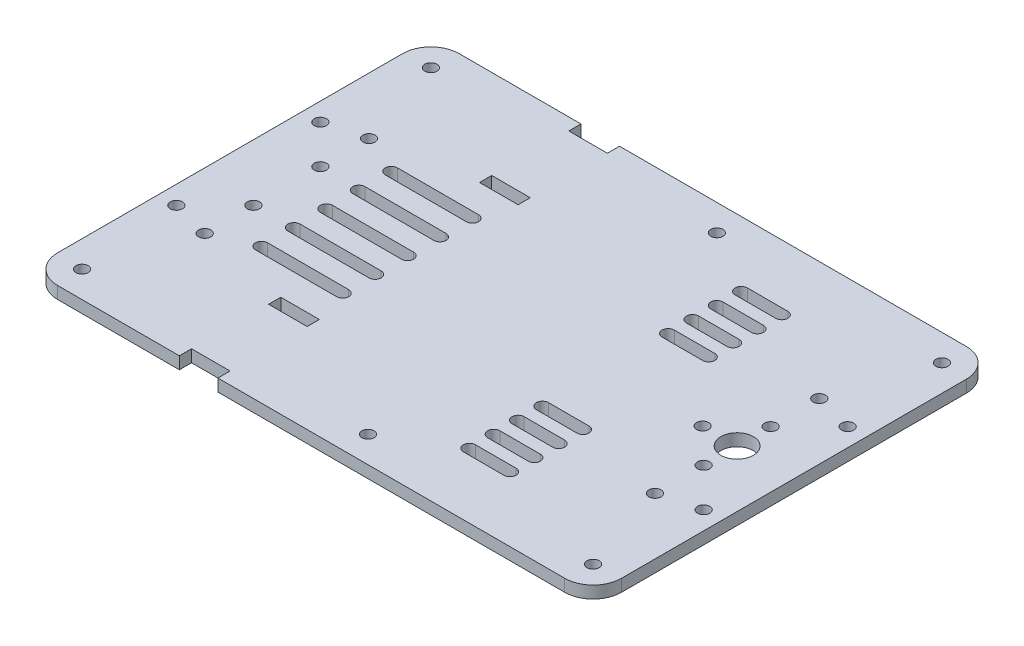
SolidWorks part; units mm, degrees
ref_plane "Front Plane" through (0, 0, 0) normal (0, 0, 1) x (1, 0, 0)
ref_plane "Top Plane" through (0, 0, 0) normal (0, 1, 0) x (1, 0, 0)
ref_plane "Right Plane" through (0, 0, 0) normal (1, 0, 0) x (0, 0, -1)
sketch "Sketch1" plane through (0, 0, 0) normal (0, 1, 0) x (1, 0, 0)
  line L0 (-32.5, 46.5) -> (-23, 46.5)
  line L1 (62.5, -49.5) -> (-62.5, -49.5)
  line L2 (69.5, -42.5) -> (69.5, 42.5)
  line L3 (62.5, 49.5) -> (-62.5, 49.5)
  line L4 (-69.5, -42.5) -> (-69.5, 42.5)
  line L5 (0, 49.5) -> (0, -49.5) construction
  line L6 (69.5, 0) -> (-69.5, 0) construction
  line L7 (-32.5, -49.5) -> (-23, -49.5)
  line L8 (-32.5, -49.5) -> (-32.5, -46.5)
  line L9 (-32.5, -46.5) -> (-23, -46.5)
  line L10 (-23, -49.5) -> (-23, -46.5)
  line L11 (-23, 49.5) -> (-23, 46.5)
  line L12 (-32.5, 49.5) -> (-23, 49.5)
  line L13 (-32.5, 49.5) -> (-32.5, 46.5)
  line L14 (-32.5, 24.5) -> (-23, 24.5)
  line L15 (-32.5, -27.5) -> (-23, -27.5)
  line L16 (-32.5, -27.5) -> (-32.5, -24.5)
  line L17 (-32.5, -24.5) -> (-23, -24.5)
  line L18 (-23, -27.5) -> (-23, -24.5)
  line L19 (-23, 27.5) -> (-23, 24.5)
  line L20 (-32.5, 27.5) -> (-23, 27.5)
  line L21 (-32.5, 27.5) -> (-32.5, 24.5)
  line L22 (-63, 43) -> (63, 43) construction
  line L23 (-63, -43) -> (63, -43) construction
  line L24 (33, 15.5) -> (23, 15.5) construction
  line L25 (33, 14) -> (23, 14)
  line L26 (33, 17) -> (23, 17)
  line L27 (33, -15.5) -> (23, -15.5) construction
  line L28 (33, -14) -> (23, -14)
  line L29 (33, -17) -> (23, -17)
  line L30 (-45.75, 16) -> (-25.75, 16) construction
  line L31 (-45.75, 17.5) -> (-25.75, 17.5)
  line L32 (-45.75, 14.5) -> (-25.75, 14.5)
  line L33 (-24.25, 27.75) -> (-24.25, 20.7276) construction
  line L34 (-45.75, 6.5) -> (-25.75, 6.5)
  line L35 (-45.75, 9.5) -> (-25.75, 9.5)
  line L36 (-45.75, 8) -> (-25.75, 8) construction
  line L37 (-45.75, -1.5) -> (-25.75, -1.5)
  line L38 (-45.75, 1.5) -> (-25.75, 1.5)
  line L39 (-45.75, 0) -> (-25.75, 0) construction
  line L40 (-45.75, -9.5) -> (-25.75, -9.5)
  line L41 (-45.75, -6.5) -> (-25.75, -6.5)
  line L42 (-45.75, -8) -> (-25.75, -8) construction
  line L43 (-45.75, -17.5) -> (-25.75, -17.5)
  line L44 (-45.75, -14.5) -> (-25.75, -14.5)
  line L45 (-45.75, -16) -> (-25.75, -16) construction
  line L46 (-63.5, 13.5) -> (-63.5, -10.25) construction
  line L47 (33, 23) -> (23, 23)
  line L48 (33, 20) -> (23, 20)
  line L49 (33, 21.5) -> (23, 21.5) construction
  line L50 (33, 29) -> (23, 29)
  line L51 (33, 26) -> (23, 26)
  line L52 (33, 27.5) -> (23, 27.5) construction
  line L53 (33, 35) -> (23, 35)
  line L54 (33, 32) -> (23, 32)
  line L55 (33, 33.5) -> (23, 33.5) construction
  line L56 (33, -33.5) -> (23, -33.5) construction
  line L57 (33, -32) -> (23, -32)
  line L58 (33, -35) -> (23, -35)
  line L59 (33, -27.5) -> (23, -27.5) construction
  line L60 (33, -26) -> (23, -26)
  line L61 (33, -29) -> (23, -29)
  line L62 (33, -21.5) -> (23, -21.5) construction
  line L63 (33, -20) -> (23, -20)
  line L64 (33, -23) -> (23, -23)
  arc A0 (69.5, 42.5) -> (62.5, 49.5) centre (62.5, 42.5) ccw
  arc A1 (62.5, -49.5) -> (69.5, -42.5) centre (62.5, -42.5) ccw
  arc A2 (-62.5, -49.5) -> (-69.5, -42.5) centre (-62.5, -42.5) cw
  arc A3 (-62.5, 49.5) -> (-69.5, 42.5) centre (-62.5, 42.5) ccw
  circle A4 centre (-63, 43) radius 1.5
  circle A5 centre (63, 43) radius 1.5
  circle A6 centre (63, -43) radius 1.5
  circle A7 centre (-63, -43) radius 1.5
  circle A8 centre (7.5, -43) radius 1.5
  circle A9 centre (7.5, 43) radius 1.5
  circle A10 centre (55.5, 8.25) radius 1.5
  circle A11 centre (55.5, -8.25) radius 1.5
  circle A12 centre (47, 0) radius 1.5
  arc A14 (33, 14) -> (33, 17) centre (33, 15.5) ccw
  arc A15 (23, 17) -> (23, 14) centre (23, 15.5) ccw
  arc A16 (33, -14) -> (33, -17) centre (33, -15.5) cw
  arc A17 (23, -17) -> (23, -14) centre (23, -15.5) cw
  circle A18 centre (55.5, -20.25) radius 1.5
  circle A20 centre (55.5, 20.25) radius 1.5
  arc A21 (-45.75, 17.5) -> (-45.75, 14.5) centre (-45.75, 16) ccw
  arc A22 (-25.75, 14.5) -> (-25.75, 17.5) centre (-25.75, 16) ccw
  arc A23 (-45.75, 9.5) -> (-45.75, 6.5) centre (-45.75, 8) ccw
  arc A24 (-25.75, 6.5) -> (-25.75, 9.5) centre (-25.75, 8) ccw
  arc A25 (-45.75, 1.5) -> (-45.75, -1.5) centre (-45.75, 0) ccw
  arc A26 (-25.75, -1.5) -> (-25.75, 1.5) centre (-25.75, 0) ccw
  arc A27 (-45.75, -6.5) -> (-45.75, -9.5) centre (-45.75, -8) ccw
  arc A28 (-25.75, -9.5) -> (-25.75, -6.5) centre (-25.75, -8) ccw
  arc A29 (-45.75, -14.5) -> (-45.75, -17.5) centre (-45.75, -16) ccw
  arc A30 (-25.75, -17.5) -> (-25.75, -14.5) centre (-25.75, -16) ccw
  circle A34 centre (-55.5, 20.25) radius 1.5
  circle A35 centre (-55.5, 8.25) radius 1.5
  circle A36 centre (-55.5, -8.25) radius 1.5
  circle A37 centre (-55.5, -20.25) radius 1.5
  circle A38 centre (-65, 17.75) radius 1.5
  circle A40 centre (-65, -17.75) radius 1.5
  circle A41 centre (65, 17.75) radius 1.5
  circle A42 centre (65, -17.75) radius 1.5
  circle A43 centre (55.5, 0) radius 4
  arc A44 (33, 20) -> (33, 23) centre (33, 21.5) ccw
  arc A45 (23, 23) -> (23, 20) centre (23, 21.5) ccw
  arc A46 (33, 26) -> (33, 29) centre (33, 27.5) ccw
  arc A47 (23, 29) -> (23, 26) centre (23, 27.5) ccw
  arc A48 (33, 32) -> (33, 35) centre (33, 33.5) ccw
  arc A49 (23, 35) -> (23, 32) centre (23, 33.5) ccw
  arc A50 (33, -32) -> (33, -35) centre (33, -33.5) cw
  arc A51 (23, -35) -> (23, -32) centre (23, -33.5) cw
  arc A52 (33, -26) -> (33, -29) centre (33, -27.5) cw
  arc A53 (23, -29) -> (23, -26) centre (23, -27.5) cw
  arc A54 (33, -20) -> (33, -23) centre (33, -21.5) cw
  arc A55 (23, -23) -> (23, -20) centre (23, -21.5) cw
  point P0 (0, 0)
  point P8 (69.5, -49.5)
  point P11 (-69.5, -49.5)
  point P15 (-69.5, 49.5)
  point P52 (28, 15.5)
  point P59 (28, -15.5)
  point P66 (-35.75, 16)
  point P79 (-35.75, 8)
  point P86 (-35.75, 0)
  point P93 (-35.75, -8)
  point P105 (-35.75, -16)
  point P133 (28, 21.5)
  point P140 (28, 27.5)
  point P147 (28, 33.5)
  point P154 (28, -33.5)
  point P161 (28, -27.5)
  point P168 (28, -21.5)
  dimension "D3" = 7
  dimension "D13" = 3
  dimension "D16" = 3
  dimension "D21" = 12
  dimension "D23" = 1.5
  dimension "D27" = 6
  dimension "D28" = 3
  dimension "D30" = 8
  dimension "D31" = 4
  dimension "D1" = 139
  dimension "D2" = 99
  dimension "D4" = 37
  dimension "D5" = 9.5
  dimension "D6" = 3
  dimension "D7" = 19
  dimension "D8" = 3
  dimension "D9" = 6.5
  dimension "D10" = 6.5
  dimension "D11" = 6.5
  dimension "D12" = 30.5
  dimension "D14" = 16.5
  dimension "D15" = 8.5
  dimension "D17" = 14
  dimension "D18" = 14
  dimension "D19" = 15.5
  dimension "D20" = 10
  dimension "D22" = 7
  dimension "D24" = 20
  dimension "D25" = 1.25
  dimension "D29" = 35.5
  dimension "D26" = 5
extrude "Boss-Extrude1" add sketch "Sketch1" along normal blind 3 contours L3 A3 L4 A2 L1 L8 L9 L10 A1 L2 A0 L11 L0 L13 L18 L15 L16 L17 L21 L20 L19 L14
